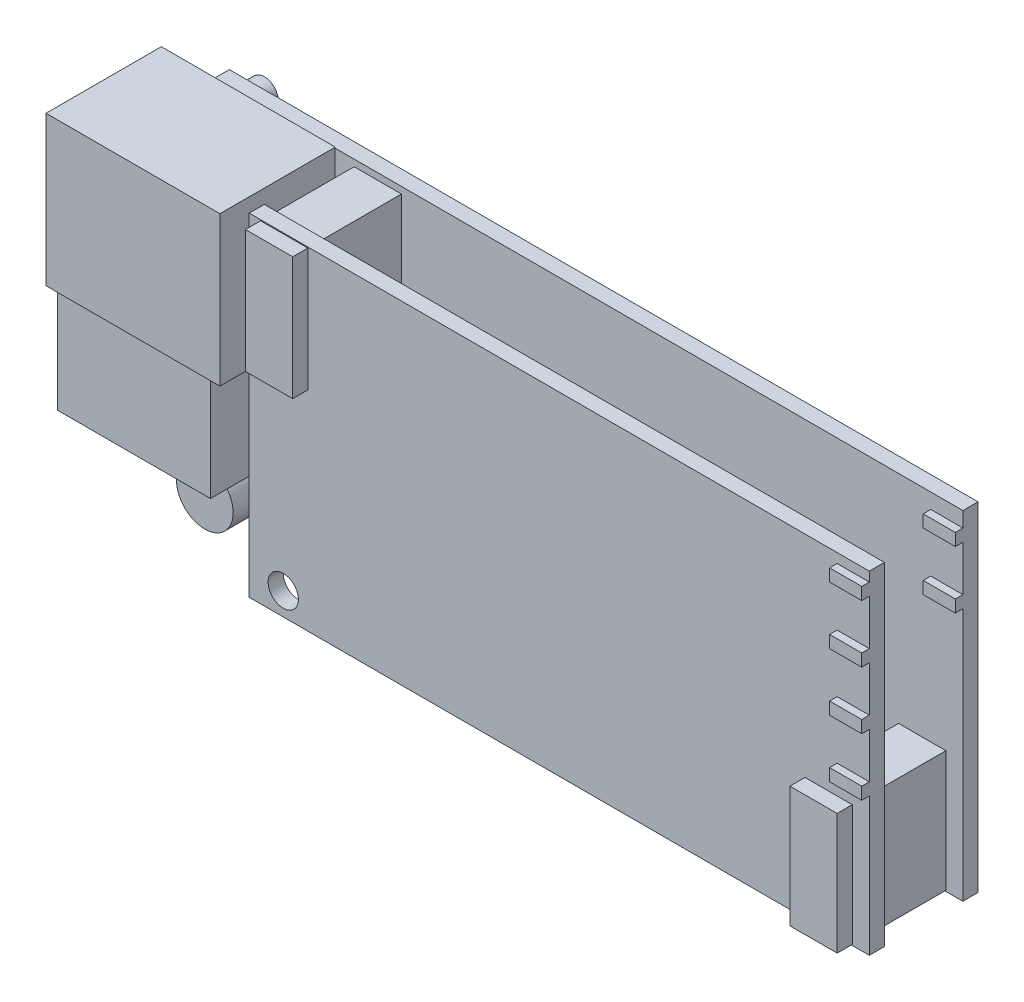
SolidWorks part; units mm, degrees
ref_plane "Front Plane" through (0, 0, 0) normal (0, 0, 1) x (1, 0, 0)
ref_plane "Top Plane" through (0, 0, 0) normal (0, 1, 0) x (1, 0, 0)
ref_plane "Right Plane" through (0, 0, 0) normal (1, 0, 0) x (0, 0, -1)
sketch "Sketch1" plane through (0, 0, 0) normal (0, 0, 1) x (1, 0, 0)
  line L1 (-33.2308, 16.5231) -> (45.9692, 16.5231)
  line L2 (-33.2308, 16.5231) -> (-33.2308, -19.2769)
  line L3 (-33.2308, -19.2769) -> (45.9692, -19.2769)
  line L4 (45.9692, 16.5231) -> (45.9692, -19.2769)
  dimension "D1" = 79.2
  dimension "D2" = 35.8
extrude "Boss-Extrude1" add sketch "Sketch1" along normal blind 1.6
ref_plane "Plane1" through (0, 0, 9.9) normal (0, 0, 1) x (1, 0, 0)
sketch "Sketch2" plane through (0, 0, 9.9) normal (0, 0, 1) x (1, 0, 0)
  line L0 (45.9692, -19.2769) -> (45.9692, 16.5231) construction
  line L1 (45.9692, -19.2769) -> (-19.6308, -19.2769)
  line L2 (45.9692, -19.2769) -> (45.9692, 15.9231)
  line L3 (45.9692, 15.9231) -> (-19.6308, 15.9231)
  line L4 (-19.6308, -19.2769) -> (-19.6308, 15.9231)
  dimension "D1" = 65.6
  dimension "D2" = 35.2
extrude "Boss-Extrude2" add sketch "Sketch2" along normal blind 1.6 separate body
ref_plane "Plane2" through (0, 0, 1.6) normal (0, 0, 1) x (1, 0, 0)
sketch "Sketch3" plane through (0, 0, 1.6) normal (0, 0, 1) x (1, 0, 0)
  line L0 (-33.2308, 16.5231) -> (-33.2308, -19.2769) construction
  line L1 (-38.8308, 16.6231) -> (-20.4308, 16.6231)
  line L2 (-38.8308, 16.6231) -> (-38.8308, 0.8231)
  line L3 (-38.8308, 0.8231) -> (-20.4308, 0.8231)
  line L4 (-20.4308, 16.6231) -> (-20.4308, 0.8231)
  line L6 (45.9692, 16.5231) -> (-33.2308, 16.5231) construction
  dimension "D1" = 15.8
  dimension "D2" = 18.4
  dimension "D3" = 5.6
  dimension "D4" = 0.1
extrude "Boss-Extrude3" add sketch "Sketch3" along normal blind 12.2
sketch "Sketch4" plane through (0, 0, 1.6) normal (0, 0, 1) x (1, 0, 0)
  line L1 (-22.8308, 0.6231) -> (-39.0308, 0.6231)
  line L2 (-22.8308, 0.6231) -> (-22.8308, -11.3769)
  line L3 (-22.8308, -11.3769) -> (-39.0308, -11.3769)
  line L4 (-39.0308, 0.6231) -> (-39.0308, -11.3769)
  line L5 (-38.8308, 0.8231) -> (-20.4308, 0.8231) construction
  line L6 (-38.8308, 16.6231) -> (-38.8308, 0.8231) construction
  dimension "D1" = 16.2
  dimension "D2" = 12
  dimension "D3" = 0.2
  dimension "D4" = 0.2
extrude "Boss-Extrude4" add sketch "Sketch4" along normal blind 10.8
sketch "Sketch5" plane through (0, 0, 1.6) normal (0, 0, 1) x (1, 0, 0)
  line L0 (-33.2308, -11.3769) -> (-33.2308, -19.2769) construction
  line L1 (-33.2308, -19.2769) -> (45.9692, -19.2769) construction
  circle A0 centre (-27.2308, -15.2769) radius 3
  dimension "D1" = 6
  dimension "D2" = 6
  dimension "D3" = 4
extrude "Boss-Extrude5" add sketch "Sketch5" along normal blind 7
ref_plane "Plane3" through (0, 0, 11.5) normal (0, 0, 1) x (1, 0, 0)
sketch "Sketch6" plane through (0, 0, 11.5) normal (0, 0, 1) x (1, 0, 0)
  line L0 (45.9692, -19.2769) -> (45.9692, 15.9231) construction
  line L1 (39.1692, -6.3769) -> (44.1692, -6.3769)
  line L2 (39.1692, -6.3769) -> (39.1692, -19.1769)
  line L3 (39.1692, -19.1769) -> (44.1692, -19.1769)
  line L4 (44.1692, -6.3769) -> (44.1692, -19.1769)
  line L6 (-19.6308, -19.2769) -> (45.9692, -19.2769) construction
  line L7 (-20.4308, 0.8231) -> (-20.4308, 16.5231) construction
  line L8 (-18.4308, 15.8231) -> (-13.4308, 15.8231)
  line L9 (-18.4308, 15.8231) -> (-18.4308, 2.8231)
  line L10 (-18.4308, 2.8231) -> (-13.4308, 2.8231)
  line L11 (-13.4308, 15.8231) -> (-13.4308, 2.8231)
  line L12 (45.9692, 15.9231) -> (-19.6308, 15.9231) construction
  dimension "D1" = 12.8
  dimension "D2" = 5
  dimension "D3" = 1.8
  dimension "D4" = 0.1
  dimension "D5" = 13
  dimension "D6" = 5
  dimension "D7" = 2
  dimension "D8" = 0.1
extrude "Boss-Extrude6" add sketch "Sketch6" along normal blind 1.6
sketch "Sketch7" plane through (0, 0, 11.5) normal (0, 0, 1) x (1, 0, 0)
  line L1 (42.5692, 14.9231) -> (45.9692, 14.9231)
  line L2 (42.5692, 14.9231) -> (42.5692, 13.6231)
  line L3 (42.5692, 13.6231) -> (45.9692, 13.6231)
  line L4 (45.9692, 14.9231) -> (45.9692, 13.6231)
  line L5 (45.9692, 15.9231) -> (-19.6308, 15.9231) construction
  line L6 (45.9692, -19.2769) -> (45.9692, 15.9231) construction
  line L7 (42.5692, 7.5231) -> (45.9692, 7.5231)
  line L8 (42.5692, 8.8231) -> (42.5692, 7.5231)
  line L9 (42.5692, 8.8231) -> (45.9692, 8.8231)
  line L10 (45.9692, 8.8231) -> (45.9692, 7.5231)
  line L11 (42.5692, 1.4231) -> (45.9692, 1.4231)
  line L12 (42.5692, 2.7231) -> (42.5692, 1.4231)
  line L13 (42.5692, 2.7231) -> (45.9692, 2.7231)
  line L14 (45.9692, 2.7231) -> (45.9692, 1.4231)
  line L15 (42.5692, -4.6769) -> (45.9692, -4.6769)
  line L16 (42.5692, -3.3769) -> (42.5692, -4.6769)
  line L17 (42.5692, -3.3769) -> (45.9692, -3.3769)
  line L18 (45.9692, -3.3769) -> (45.9692, -4.6769)
  dimension "D1" = 3.4
  dimension "D2" = 1.3
  dimension "D3" = 1
  dimension "D5" = 4.8
  dimension "D4" = 4
extrude "Boss-Extrude7" add sketch "Sketch7" along normal blind 0.8
sketch "Sketch8" plane through (0, 0, 1.6) normal (0, 0, 1) x (1, 0, 0)
  line L0 (45.9692, 2.7231) -> (45.9692, 7.5231) construction
  line L1 (42.5692, 13.6231) -> (45.9692, 13.6231)
  line L2 (42.5692, 13.6231) -> (42.5692, 14.9231)
  line L3 (42.5692, 14.9231) -> (45.9692, 14.9231)
  line L4 (45.9692, 13.6231) -> (45.9692, 14.9231)
  line L5 (42.5692, 7.5231) -> (45.9692, 7.5231)
  line L6 (42.5692, 7.5231) -> (42.5692, 8.8231)
  line L7 (42.5692, 8.8231) -> (45.9692, 8.8231)
  line L8 (45.9692, 7.5231) -> (45.9692, 8.8231)
  line L9 (45.9692, 8.8231) -> (45.9692, 13.6231) construction
  line L11 (45.9692, 16.5231) -> (-20.4308, 16.5231) construction
  dimension "D1" = 3.4
  dimension "D2" = 3.4
  dimension "D3" = 1.6
  dimension "D4" = 1.3
  dimension "D5" = 1.3
  dimension "D6" = 4.8
extrude "Boss-Extrude8" add sketch "Sketch8" along normal blind 0.8
ref_plane "Plane4" through (0, 0, 0) normal (0, 0, -1) x (-1, 0, 0)
sketch "Sketch9" plane through (0, 0, 0) normal (0, 0, -1) x (-1, 0, 0)
  line L0 (33.2308, 16.5231) -> (33.2308, 0.8231) construction
  line L1 (5.6308, 8.5231) -> (2.2308, 8.5231)
  line L2 (5.6308, 8.5231) -> (5.6308, 14.7231)
  line L3 (5.6308, 14.7231) -> (2.2308, 14.7231)
  line L4 (2.2308, 8.5231) -> (2.2308, 14.7231)
  line L5 (-8.1692, 8.5231) -> (-11.5692, 8.5231)
  line L6 (-8.1692, 8.5231) -> (-8.1692, 14.7231)
  line L7 (-8.1692, 14.7231) -> (-11.5692, 14.7231)
  line L8 (-11.5692, 8.5231) -> (-11.5692, 14.7231)
  line L9 (-45.9692, 16.5231) -> (33.2308, 16.5231) construction
  dimension "D1" = 6.2
  dimension "D2" = 6.2
  dimension "D3" = 3.4
  dimension "D4" = 3.4
  dimension "D5" = 10.4
  dimension "D6" = 31
  dimension "D7" = 1.8
  dimension "D8" = 1.8
extrude "Boss-Extrude9" add sketch "Sketch9" along normal blind 1.8
sketch "Sketch10" plane through (0, 0, 0) normal (0, 0, -1) x (-1, 0, 0)
  line L0 (33.2308, -19.2769) -> (-45.9692, -19.2769) construction
  line L1 (17.2308, -9.7769) -> (7.2308, -9.7769)
  line L2 (17.2308, -9.7769) -> (17.2308, 0.2231)
  line L3 (17.2308, 0.2231) -> (7.2308, 0.2231)
  line L4 (7.2308, -9.7769) -> (7.2308, 0.2231)
  line L5 (33.2308, 16.5231) -> (33.2308, -19.2769) construction
  dimension "D1" = 19.5
  dimension "D2" = 26
  dimension "D3" = 10
  dimension "D4" = 10
extrude "Boss-Extrude10" add sketch "Sketch10" along normal blind 2.2
sketch "Sketch11" plane through (0, 0, 0) normal (0, 0, -1) x (-1, 0, 0)
  line L0 (33.2308, -19.2769) -> (-45.9692, -19.2769) construction
  line L1 (-1.9692, -8.5769) -> (-15.7692, -8.5769)
  line L2 (-1.9692, -8.5769) -> (-1.9692, 5.2231)
  line L3 (-1.9692, 5.2231) -> (-15.7692, 5.2231)
  line L4 (-15.7692, -8.5769) -> (-15.7692, 5.2231)
  line L5 (33.2308, 16.5231) -> (33.2308, -19.2769) construction
  point P8 (33.2308, -1.3769)
  dimension "D1" = 24.5
  dimension "D2" = 13.8
  dimension "D3" = 13.8
  dimension "D4" = 49
extrude "Boss-Extrude11" add sketch "Sketch11" along normal blind 1.6
sketch "Sketch12" plane through (0, 0, 1.6) normal (0, 0, 1) x (1, 0, 0)
  line L0 (-33.2308, -19.2769) -> (45.9692, -19.2769) construction
  line L1 (39.1692, -6.3769) -> (44.1692, -6.3769)
  line L2 (39.1692, -6.3769) -> (39.1692, -19.1769)
  line L3 (39.1692, -19.1769) -> (44.1692, -19.1769)
  line L4 (44.1692, -6.3769) -> (44.1692, -19.1769)
  line L5 (45.9692, -19.2769) -> (45.9692, 7.5231) construction
  line L6 (45.9692, 15.9231) -> (-19.6308, 15.9231) construction
  line L7 (-18.4308, 15.8231) -> (-13.4308, 15.8231)
  line L8 (-18.4308, 15.8231) -> (-18.4308, 2.8231)
  line L9 (-18.4308, 2.8231) -> (-13.4308, 2.8231)
  line L10 (-13.4308, 15.8231) -> (-13.4308, 2.8231)
  line L11 (-20.4308, 0.8231) -> (-20.4308, 16.5231) construction
  dimension "D1" = 0.1
  dimension "D2" = 1.8
  dimension "D3" = 0.1
  dimension "D4" = 5
  dimension "D5" = 2
  dimension "D6" = 13
extrude "Boss-Extrude12" add sketch "Sketch12" along normal up to surface (8.3 mm away)
sketch "Sketch13" plane through (0, 0, 0) normal (0, 0, -1) x (-1, 0, 0)
  line L0 (-45.9692, -19.2769) -> (-45.9692, 16.5231) construction
  line L1 (-23.5692, -11.0769) -> (-33.9692, -11.0769)
  line L2 (-23.5692, -11.0769) -> (-23.5692, 9.9231)
  line L3 (-23.5692, 9.9231) -> (-33.9692, 9.9231)
  line L4 (-33.9692, -11.0769) -> (-33.9692, 9.9231)
  line L5 (-45.9692, 16.5231) -> (33.2308, 16.5231) construction
  dimension "D1" = 21
  dimension "D2" = 10.4
  dimension "D3" = 22.4
  dimension "D4" = 27.6
extrude "Boss-Extrude13" add sketch "Sketch13" along normal blind 1
sketch "Sketch14" plane through (0, 0, 0) normal (0, 0, -1) x (-1, 0, 0)
  line L0 (33.2308, -19.2769) -> (-45.9692, -19.2769) construction
  line L1 (-37.9692, -2.2769) -> (-39.4692, -2.2769)
  line L2 (-37.9692, -2.2769) -> (-37.9692, 1.3231)
  line L3 (-37.9692, 1.3231) -> (-39.4692, 1.3231)
  line L4 (-39.4692, -2.2769) -> (-39.4692, 1.3231)
  point P4 (-38.7192, -2.2769)
  dimension "D1" = 3.6
  dimension "D2" = 1.5
  dimension "D3" = 8
  dimension "D4" = 17
extrude "Boss-Extrude14" add sketch "Sketch14" along normal blind 1.4
sketch "Sketch15" plane through (0, 0, 0) normal (0, 0, 1) x (1, 0, 0)
  line L0 (-19.6308, 15.9231) -> (-19.6308, -19.2769) construction
  line L2 (-19.6308, -19.2769) -> (45.9692, -19.2769) construction
  circle A0 centre (-16.0308, -16.8769) radius 1.6
  dimension "D1" = 3.2
  dimension "D2" = 3.6
  dimension "D3" = 2.4
extrude "Cut-Extrude1" cut sketch "Sketch15" along normal blind 14.4
ref_plane "Plane5" through (0, 16.6231, 0) normal (0, 1, 0) x (1, 0, 0)
sketch "Sketch16" plane through (0, 16.6231, 0) normal (0, 1, 0) x (1, 0, 0)
  line L1 (38.1677, -14.7567) -> (-45.1873, -14.7567)
  line L2 (38.1677, -14.7567) -> (38.1677, 6.7241)
  line L3 (38.1677, 6.7241) -> (-45.1873, 6.7241)
  line L4 (-45.1873, -14.7567) -> (-45.1873, 6.7241)
sketch "Sketch17" plane through (0, 0, 0) normal (0, 0, 1) x (1, 0, 0)
  line L0 (45.9692, 16.5231) -> (-33.2308, 16.5231) construction
  line L1 (-33.2308, 16.5231) -> (-33.2308, -19.2769) construction
  circle A0 centre (-31.2308, 14.5231) radius 1.5
  dimension "D1" = 3
  dimension "D2" = 2
  dimension "D3" = 2
extrude "Boss-Extrude15" add sketch "Sketch17" against normal blind 1.7
